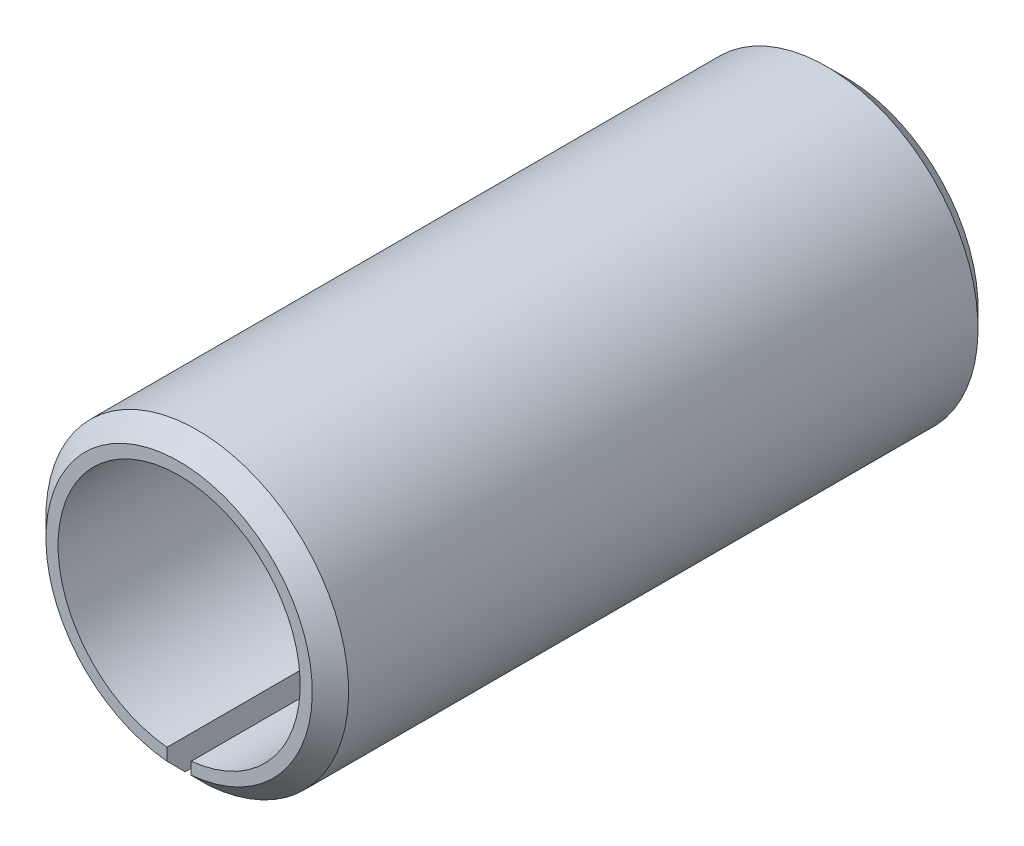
SolidWorks part; units mm, degrees
ref_plane "Plan de face" through (0, 0, 0) normal (0, 0, 1) x (1, 0, 0)
ref_plane "Plan de dessus" through (0, 0, 0) normal (0, 1, 0) x (1, 0, 0)
ref_plane "Plan de droite" through (0, 0, 0) normal (1, 0, 0) x (0, 0, -1)
sketch "Esquisse1" plane through (0, 0, 0) normal (0, 0, 1) x (1, 0, 0)
  line L2 (-0.2, -1.99) -> (-0.2, -2.492)
  line L4 (0.2, -1.99) -> (0.2, -2.492)
  arc A0 (0.2, -1.99) -> (-0.2, -1.99) centre (0, 0) ccw
  arc A1 (0.2, -2.492) -> (-0.2, -2.492) centre (0, 0) ccw
  dimension "D1" = 4
  dimension "D2" = 5
  dimension "D3" = 0.2
extrude "Extrusion1" add sketch "Esquisse1" along normal blind 11
chamfer "Chanfrein1" distance 0.3 angle 45 2 edges at (0, 2.5, 0) (0, 2.5, 11)
